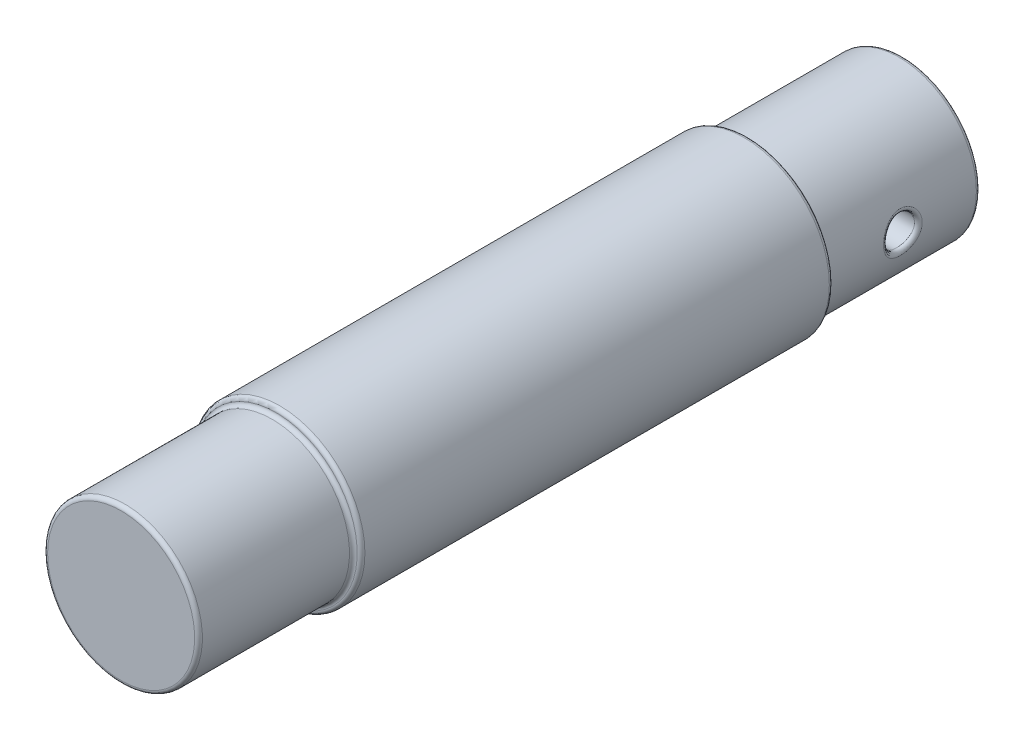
SolidWorks part; units mm, degrees
ref_plane "Спереди" through (0, 0, 0) normal (0, 0, 1) x (1, 0, 0)
ref_plane "Сверху" through (0, 0, 0) normal (0, 1, 0) x (1, 0, 0)
ref_plane "Справа" through (0, 0, 0) normal (1, 0, 0) x (0, 0, -1)
sketch "Эскиз1" plane through (0, 0, 0) normal (1, 0, 0) x (0, 0, -1)
  line L0 (-50.5, 0) -> (50.5, 0)
  line L1 (-50.5, 0) -> (-50.5, 10)
  line L2 (-50.5, 10) -> (-30.5, 10)
  line L3 (-30.5, 10) -> (-30.5, 11)
  line L4 (-30.5, 11) -> (30.5, 11)
  line L5 (30.5, 11) -> (30.5, 10)
  line L6 (30.5, 10) -> (50.5, 10)
  line L7 (50.5, 10) -> (50.5, 0)
  dimension "D1" = 101
  dimension "D2" = 10
  dimension "D3" = 11
  dimension "D4" = 61
revolve "Повернуть1" add sketch "Эскиз1" angle 360 about L0
sketch "Эскиз2" plane through (0, 0, 0) normal (1, 0, 0) x (0, 0, -1)
  line L0 (50.5, -10) -> (50.5, 10) construction
  circle A0 centre (40.5, 0) radius 2
  dimension "D1" = 4
  dimension "D2" = 10
extrude "Вырез-Вытянуть1" cut sketch "Эскиз2" against normal mid plane 20
sketch "Эскиз3" plane through (0, 0, 0) normal (0, 1, 0) x (1, 0, 0)
  line L0 (-8, 11.3071) -> (-8, -10.6917) construction
  line L1 (-11, 30.5) -> (-11, -30.5) construction
  circle A0 centre (-30, 0) radius 22
  dimension "D1" = 44
  dimension "D2" = 3
extrude "Вырез-Вытянуть2" cut sketch "Эскиз3" against normal mid plane 20
fillet "Скругление1" radius 0.5 9 edges at (11, 0, -30.5) (11, 0, 30.5) (10, 0, -50.5) (10, 0, -30.5) (-9.9914, -0.4155, -38.5436) (9.9914, 0.4155, -38.5436) (10, 0, 30.5) (10, 0, 50.5) (-10.8208, -1.9775, 10.7776)
